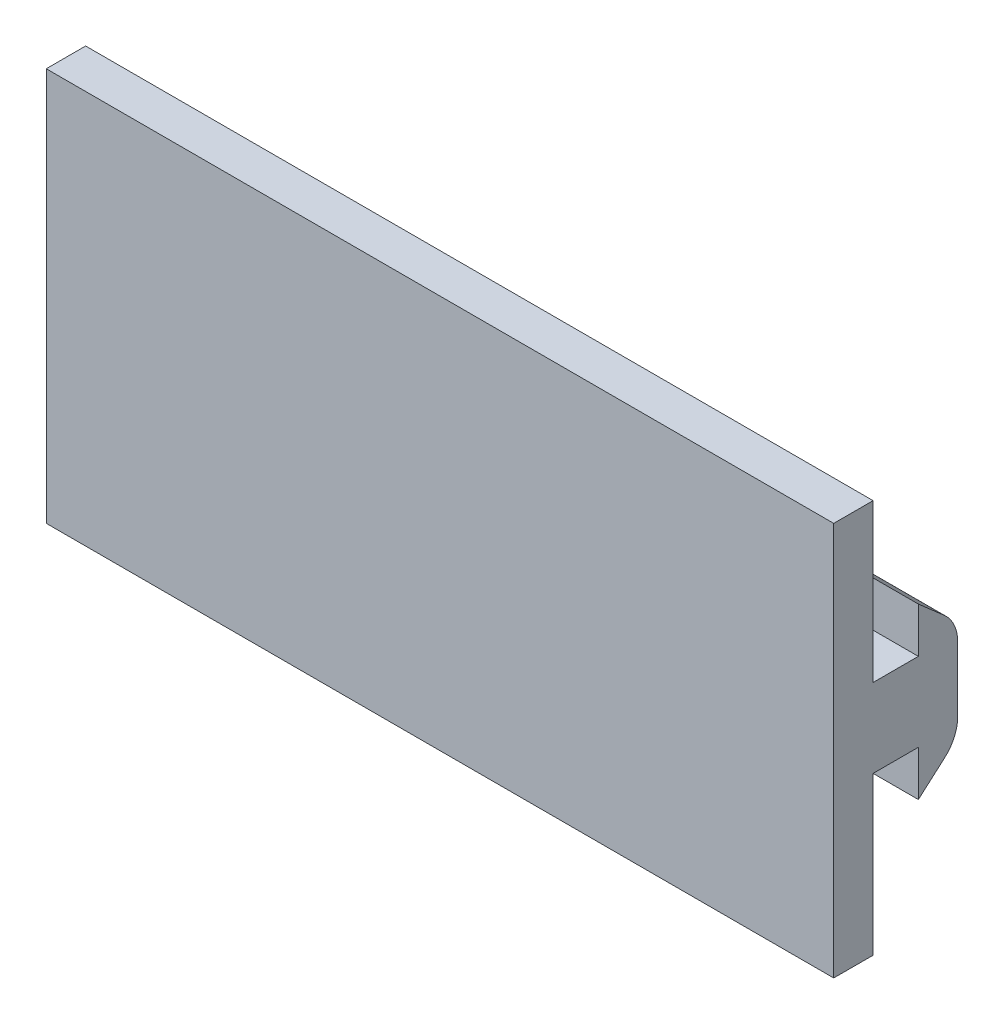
SolidWorks part; units mm, degrees
ref_plane "Front Plane" through (0, 0, 0) normal (0, 0, 1) x (1, 0, 0)
ref_plane "Top Plane" through (0, 0, 0) normal (0, 1, 0) x (1, 0, 0)
ref_plane "Right Plane" through (0, 0, 0) normal (1, 0, 0) x (0, 0, -1)
sketch "Sketch1" plane through (0, 0, 0) normal (0, 0, 1) x (1, 0, 0)
  line L1 (-41.91, -12.7) -> (41.91, -12.7)
  line L2 (-41.91, -12.7) -> (-41.91, 12.7)
  line L3 (-41.91, 12.7) -> (41.91, 12.7)
  line L4 (41.91, -12.7) -> (41.91, 12.7)
  line L5 (-41.91, -12.7) -> (41.91, 12.7) construction
  line L6 (-41.91, 12.7) -> (41.91, -12.7) construction
  point P0 (0, 0)
  dimension "D1" = 83.82
  dimension "D2" = 25.4
extrude "Boss-Extrude1" add sketch "Sketch1" along normal blind 12.7
sketch "Sketch3" plane through (0, 0, 12.7) normal (0, 0, 1) x (1, 0, 0)
  line L0 (41.91, -6.86) -> (41.91, -7.62)
  line L1 (-41.91, -6.86) -> (-41.91, -7.8218)
  line L2 (-41.4131, -6.6226) -> (-41.415, -6.71)
  line L3 (-40.3041, -6.6534) -> (-40.3058, -6.6983)
  line L6 (-40.8652, -6.1) -> (-40.8591, -6.1)
  line L7 (-38.8652, -6.1) -> (-38.8591, -6.1)
  line L12 (-39.4131, -6.6226) -> (-39.415, -6.71)
  line L13 (-38.3041, -6.6534) -> (-38.3058, -6.6983)
  line L14 (-37.4131, -6.6226) -> (-37.415, -6.71)
  line L15 (-36.8652, -6.1) -> (-36.8591, -6.1)
  line L16 (-34.8652, -6.1) -> (-34.8591, -6.1)
  line L17 (-32.8652, -6.1) -> (-32.8591, -6.1)
  line L18 (-30.8652, -6.1) -> (-30.8591, -6.1)
  line L19 (-28.8652, -6.1) -> (-28.8591, -6.1)
  line L20 (-26.8654, -6.1) -> (-26.8591, -6.1)
  line L21 (-24.8652, -6.1) -> (-24.8591, -6.1)
  line L27 (34.8591, -6.1) -> (34.8652, -6.1)
  line L28 (36.8591, -6.1) -> (36.8652, -6.1)
  line L29 (38.8591, -6.1) -> (38.8652, -6.1)
  line L30 (40.8591, -6.1) -> (40.8652, -6.1)
  line L32 (32.8652, -6.1) -> (29.456, -5.9831)
  line L33 (-41.91, -12.7) -> (41.91, -12.7) construction
  line L34 (41.91, -5.465) -> (29.4688, -5.465) construction
  line L35 (41.91, -12.7) -> (41.91, 12.7) construction
  line L38 (31.565, -7.82) -> (29.0504, -7.931)
  line L40 (-41.91, -7.8218) -> (-41.91, -8.0218)
  line L41 (-41.91, -8.0218) -> (-22.86, -8.0218)
  line L42 (-22.86, -7.8218) -> (-22.86, -8.0218)
  line L45 (31.565, -7.82) -> (41.91, -7.82)
  line L46 (41.91, -7.62) -> (41.91, -7.82)
  line L47 (22.1752, -12.7) -> (24.143, -12.7)
  line L390 (33.415, -6.6226) -> (33.4131, -6.6226)
  line L391 (33.415, -6.71) -> (33.415, -6.6226)
  line L392 (34.1562, -6.86) -> (33.565, -6.86)
  line L393 (34.3041, -6.6534) -> (34.3041, -6.6559)
  line L398 (35.415, -6.6226) -> (35.4131, -6.6226)
  line L399 (35.415, -6.71) -> (35.415, -6.6226)
  line L400 (36.1562, -6.86) -> (35.565, -6.86)
  line L401 (36.3041, -6.6534) -> (36.3041, -6.6559)
  line L406 (37.415, -6.6226) -> (37.4131, -6.6226)
  line L407 (37.415, -6.71) -> (37.415, -6.6226)
  line L408 (38.1562, -6.86) -> (37.565, -6.86)
  line L409 (38.3041, -6.6534) -> (38.3041, -6.6559)
  line L414 (39.415, -6.6226) -> (39.4131, -6.6226)
  line L415 (39.415, -6.71) -> (39.415, -6.6226)
  line L416 (40.1562, -6.86) -> (39.565, -6.86)
  line L417 (40.3041, -6.6534) -> (40.3041, -6.6559)
  line L422 (41.415, -6.6226) -> (41.4131, -6.6226)
  line L423 (41.415, -6.71) -> (41.415, -6.6226)
  line L424 (41.91, -6.86) -> (41.565, -6.86)
  line L1628 (0, -27.3539) -> (0, 27.3539) construction
  line L1698 (-41.91, -6.86) -> (-41.565, -6.86)
  line L1706 (-40.1562, -6.86) -> (-39.565, -6.86)
  line L1714 (-38.1562, -6.86) -> (-37.565, -6.86)
  line L1721 (-36.3041, -6.6534) -> (-36.3041, -6.6559)
  line L1722 (-36.1562, -6.86) -> (-35.565, -6.86)
  line L1723 (-35.415, -6.71) -> (-35.415, -6.6226)
  line L1724 (-35.415, -6.6226) -> (-35.4131, -6.6226)
  line L1729 (-34.3041, -6.6534) -> (-34.3041, -6.6559)
  line L1730 (-34.1562, -6.86) -> (-33.565, -6.86)
  line L1731 (-33.415, -6.71) -> (-33.415, -6.6226)
  line L1732 (-33.415, -6.6226) -> (-33.4131, -6.6226)
  line L1737 (-32.3041, -6.6534) -> (-32.3041, -6.6559)
  line L1738 (-32.1562, -6.86) -> (-31.565, -6.86)
  line L1739 (-31.415, -6.71) -> (-31.415, -6.6226)
  line L1740 (-31.415, -6.6226) -> (-31.4131, -6.6226)
  line L1745 (-30.3041, -6.6534) -> (-30.3041, -6.6559)
  line L1746 (-30.1562, -6.86) -> (-29.565, -6.86)
  line L1747 (-29.415, -6.71) -> (-29.415, -6.6226)
  line L1748 (-29.415, -6.6226) -> (-29.4131, -6.6226)
  line L1753 (-28.3041, -6.6534) -> (-28.3041, -6.6559)
  line L1754 (-28.1562, -6.86) -> (-27.565, -6.86)
  line L1755 (-27.415, -6.71) -> (-27.415, -6.6226)
  line L1756 (-27.415, -6.6226) -> (-27.4131, -6.6226)
  line L1761 (-26.3041, -6.6535) -> (-26.3041, -6.656)
  line L1762 (-26.1563, -6.86) -> (-25.5651, -6.8601)
  line L1763 (-25.4151, -6.7101) -> (-25.4151, -6.6226)
  line L1764 (-25.4151, -6.6226) -> (-25.4132, -6.6226)
  line L1769 (-24.3041, -6.6534) -> (-24.3041, -6.6549)
  line L1770 (-24.1562, -6.86) -> (-23.565, -6.86)
  line L1771 (-23.415, -6.71) -> (-23.415, -6.6226)
  line L1772 (-23.415, -6.6226) -> (-23.4131, -6.6226)
  line L1773 (-22.8652, -6.1) -> (-22.86, -7.3726)
  line L1774 (-22.86, -7.3726) -> (-22.86, -7.8218)
  arc A3 (29.456, -5.9831) -> (22.1752, -12.7) centre (28.9139, -12.7) ccw
  arc A5 (29.0504, -7.931) -> (24.143, -12.7) centre (28.9139, -12.7) ccw
  arc A235 (33.4131, -6.6226) -> (32.8652, -6.1) centre (32.8591, -6.655) ccw
  arc A236 (33.415, -6.71) -> (33.565, -6.86) centre (33.565, -6.71) ccw
  arc A237 (34.1562, -6.86) -> (34.3058, -6.6983) centre (34.1562, -6.71) ccw
  arc A238 (34.3041, -6.6559) -> (34.3058, -6.6983) centre (34.8591, -6.655) ccw
  arc A239 (34.8591, -6.1) -> (34.3041, -6.6534) centre (34.8591, -6.655) ccw
  arc A240 (35.4131, -6.6226) -> (34.8652, -6.1) centre (34.8591, -6.655) ccw
  arc A241 (35.415, -6.71) -> (35.565, -6.86) centre (35.565, -6.71) ccw
  arc A242 (36.1562, -6.86) -> (36.3058, -6.6983) centre (36.1562, -6.71) ccw
  arc A243 (36.3041, -6.6559) -> (36.3058, -6.6983) centre (36.8591, -6.655) ccw
  arc A244 (36.8591, -6.1) -> (36.3041, -6.6534) centre (36.8591, -6.655) ccw
  arc A245 (37.4131, -6.6226) -> (36.8652, -6.1) centre (36.8591, -6.655) ccw
  arc A246 (37.415, -6.71) -> (37.565, -6.86) centre (37.565, -6.71) ccw
  arc A247 (38.1562, -6.86) -> (38.3058, -6.6983) centre (38.1562, -6.71) ccw
  arc A248 (38.3041, -6.6559) -> (38.3058, -6.6983) centre (38.8591, -6.655) ccw
  arc A249 (38.8591, -6.1) -> (38.3041, -6.6534) centre (38.8591, -6.655) ccw
  arc A250 (39.4131, -6.6226) -> (38.8652, -6.1) centre (38.8591, -6.655) ccw
  arc A251 (39.415, -6.71) -> (39.565, -6.86) centre (39.565, -6.71) ccw
  arc A252 (40.1562, -6.86) -> (40.3058, -6.6983) centre (40.1562, -6.71) ccw
  arc A253 (40.3041, -6.6559) -> (40.3058, -6.6983) centre (40.8591, -6.655) ccw
  arc A254 (40.8591, -6.1) -> (40.3041, -6.6534) centre (40.8591, -6.655) ccw
  arc A255 (41.4131, -6.6226) -> (40.8652, -6.1) centre (40.8591, -6.655) ccw
  arc A256 (41.415, -6.71) -> (41.565, -6.86) centre (41.565, -6.71) ccw
  arc A1043 (-41.415, -6.71) -> (-41.565, -6.86) centre (-41.565, -6.71) cw
  arc A1044 (-41.4131, -6.6226) -> (-40.8652, -6.1) centre (-40.8591, -6.655) cw
  arc A1045 (-40.8591, -6.1) -> (-40.3041, -6.6534) centre (-40.8591, -6.655) cw
  arc A1047 (-40.1562, -6.86) -> (-40.3058, -6.6983) centre (-40.1562, -6.71) cw
  arc A1048 (-39.415, -6.71) -> (-39.565, -6.86) centre (-39.565, -6.71) cw
  arc A1049 (-39.4131, -6.6226) -> (-38.8652, -6.1) centre (-38.8591, -6.655) cw
  arc A1050 (-38.8591, -6.1) -> (-38.3041, -6.6534) centre (-38.8591, -6.655) cw
  arc A1052 (-38.1562, -6.86) -> (-38.3058, -6.6983) centre (-38.1562, -6.71) cw
  arc A1053 (-37.415, -6.71) -> (-37.565, -6.86) centre (-37.565, -6.71) cw
  arc A1054 (-37.4131, -6.6226) -> (-36.8652, -6.1) centre (-36.8591, -6.655) cw
  arc A1055 (-36.8591, -6.1) -> (-36.3041, -6.6534) centre (-36.8591, -6.655) cw
  arc A1056 (-36.3041, -6.6559) -> (-36.3058, -6.6983) centre (-36.8591, -6.655) cw
  arc A1057 (-36.1562, -6.86) -> (-36.3058, -6.6983) centre (-36.1562, -6.71) cw
  arc A1058 (-35.415, -6.71) -> (-35.565, -6.86) centre (-35.565, -6.71) cw
  arc A1059 (-35.4131, -6.6226) -> (-34.8652, -6.1) centre (-34.8591, -6.655) cw
  arc A1060 (-34.8591, -6.1) -> (-34.3041, -6.6534) centre (-34.8591, -6.655) cw
  arc A1061 (-34.3041, -6.6559) -> (-34.3058, -6.6983) centre (-34.8591, -6.655) cw
  arc A1062 (-34.1562, -6.86) -> (-34.3058, -6.6983) centre (-34.1562, -6.71) cw
  arc A1063 (-33.415, -6.71) -> (-33.565, -6.86) centre (-33.565, -6.71) cw
  arc A1064 (-33.4131, -6.6226) -> (-32.8652, -6.1) centre (-32.8591, -6.655) cw
  arc A1065 (-32.8591, -6.1) -> (-32.3041, -6.6534) centre (-32.8591, -6.655) cw
  arc A1066 (-32.3041, -6.6559) -> (-32.3058, -6.6983) centre (-32.8591, -6.655) cw
  arc A1067 (-32.1562, -6.86) -> (-32.3058, -6.6983) centre (-32.1562, -6.71) cw
  arc A1068 (-31.415, -6.71) -> (-31.565, -6.86) centre (-31.565, -6.71) cw
  arc A1069 (-31.4131, -6.6226) -> (-30.8652, -6.1) centre (-30.8591, -6.655) cw
  arc A1070 (-30.8591, -6.1) -> (-30.3041, -6.6534) centre (-30.8591, -6.655) cw
  arc A1071 (-30.3041, -6.6559) -> (-30.3058, -6.6983) centre (-30.8591, -6.655) cw
  arc A1072 (-30.1562, -6.86) -> (-30.3058, -6.6983) centre (-30.1562, -6.71) cw
  arc A1073 (-29.415, -6.71) -> (-29.565, -6.86) centre (-29.565, -6.71) cw
  arc A1074 (-29.4131, -6.6226) -> (-28.8652, -6.1) centre (-28.8591, -6.655) cw
  arc A1075 (-28.8591, -6.1) -> (-28.3041, -6.6534) centre (-28.8591, -6.655) cw
  arc A1076 (-28.3041, -6.6559) -> (-28.3058, -6.6983) centre (-28.8591, -6.655) cw
  arc A1077 (-28.1562, -6.86) -> (-28.3058, -6.6983) centre (-28.1562, -6.71) cw
  arc A1078 (-27.415, -6.71) -> (-27.565, -6.86) centre (-27.565, -6.71) cw
  arc A1079 (-27.4131, -6.6226) -> (-26.8654, -6.1) centre (-26.8591, -6.655) cw
  arc A1080 (-26.8591, -6.1) -> (-26.3041, -6.6535) centre (-26.8591, -6.655) cw
  arc A1081 (-26.3041, -6.656) -> (-26.3058, -6.6983) centre (-26.8591, -6.655) cw
  arc A1082 (-26.1563, -6.86) -> (-26.3058, -6.6983) centre (-26.1563, -6.71) cw
  arc A1083 (-25.4151, -6.7101) -> (-25.5651, -6.8601) centre (-25.5651, -6.7101) cw
  arc A1084 (-25.4132, -6.6226) -> (-24.8652, -6.1) centre (-24.8591, -6.655) cw
  arc A1085 (-24.8591, -6.1) -> (-24.3041, -6.6534) centre (-24.8591, -6.655) cw
  arc A1086 (-24.3041, -6.6549) -> (-24.3058, -6.6983) centre (-24.8591, -6.655) cw
  arc A1087 (-24.1562, -6.86) -> (-24.3058, -6.6983) centre (-24.1562, -6.71) cw
  arc A1088 (-23.415, -6.71) -> (-23.565, -6.86) centre (-23.565, -6.71) cw
  arc A1089 (-23.4131, -6.6226) -> (-22.8652, -6.1) centre (-22.8591, -6.655) cw
  point P24 (0, 0)
  dimension "D1" = 0.635
  dimension "D3" = 0.76
sketch "Sketch4" plane through (0, 0, 12.7) normal (0, 0, 1) x (1, 0, 0)
  line L1 (-19.05, -12.7) -> (19.05, -12.7)
  line L2 (-19.05, -12.7) -> (-19.05, 12.7)
  line L3 (-19.05, 12.7) -> (19.05, 12.7)
  line L4 (19.05, -12.7) -> (19.05, 12.7)
  line L5 (-19.05, -12.7) -> (19.05, 12.7) construction
  line L6 (-19.05, 12.7) -> (19.05, -12.7) construction
  point P0 (0, 0)
  dimension "D1" = 38.1
extrude "Boss-Extrude2" add sketch "Sketch4" along normal blind 38.1
sketch "Sketch5" plane through (0, 12.7, 0) normal (0, 1, 0) x (1, 0, 0)
  line L1 (-13.335, -45.085) -> (13.335, -45.085)
  line L2 (-13.335, -45.085) -> (-13.335, -18.415)
  line L3 (-13.335, -18.415) -> (13.335, -18.415)
  line L4 (13.335, -45.085) -> (13.335, -18.415)
  line L5 (-13.335, -45.085) -> (13.335, -18.415) construction
  line L6 (-13.335, -18.415) -> (13.335, -45.085) construction
  line L8 (-19.05, -50.8) -> (-19.05, -12.7) construction
  line L9 (19.05, -50.8) -> (-19.05, -50.8) construction
  point P0 (0, -31.75)
  point P9 (0, -31.75)
  dimension "D1" = 19.05
  dimension "D2" = 26.67
  dimension "D3" = 26.67
  dimension "D4" = 19.05
extrude "Cut-Extrude1" cut sketch "Sketch5" against normal blind 19.05
sketch "Sketch7" plane through (0, -6.35, 0) normal (0, 1, 0) x (1, 0, 0)
  line L0 (-13.335, -45.085) -> (13.335, -45.085) construction
  circle A0 centre (0, -31.75) radius 3.429
  point P0 (0, -31.75)
  dimension "D2" = 6.858
  dimension "D1" = 13.335
extrude "Cut-Extrude2" cut sketch "Sketch7" against normal through all
sketch "Sketch8" plane through (-41.91, 0, 0) normal (-1, 0, 0) x (0, 0, 1)
  line L0 (0, 12.7) -> (0, -12.7) construction
  line L2 (-5.461, 2.085) -> (-5.461, -2.085)
  line L5 (0, 2.54) -> (0, -2.54)
  line L7 (-4.5942, 3.996) -> (-2.921, 5.461)
  line L8 (-2.921, 5.461) -> (-2.921, 2.54)
  line L10 (-2.921, -5.461) -> (-2.921, -2.54)
  line L11 (-4.5942, -3.996) -> (-2.921, -5.461)
  line L12 (-2.921, 2.54) -> (0, 2.54)
  line L13 (-2.921, -2.54) -> (0, -2.54)
  arc A0 (-4.5942, 3.996) -> (-5.461, 2.085) centre (-2.921, 2.085) ccw
  arc A1 (-5.461, -2.085) -> (-4.5942, -3.996) centre (-2.921, -2.085) ccw
  point P0 (-3.937, -1.0959)
  dimension "D1" = 2.54
  dimension "D2" = 2.54
  dimension "D7" = 2.921
  dimension "D3" = 5.08
  dimension "D4" = 2.921
  dimension "D5" = 2.54
  dimension "D6" = 2.921
  dimension "D8" = 2.921
  dimension "D9" = 2.54
extrude "Boss-Extrude3" add sketch "Sketch8" against normal blind 83.82
sketch "Sketch10" plane through (41.91, 0, 0) normal (1, 0, 0) x (0, 0, -1)
  line L0 (-12.7, -12.7) -> (-12.7, 12.7) construction
  line L1 (-12.7, 7.62) -> (-4.7, 7.62)
  line L2 (-12.7, 7.62) -> (-12.7, 3.62)
  line L3 (-12.7, 3.62) -> (-4.7, 3.62)
  line L4 (-4.7, 7.62) -> (-4.7, 3.62)
  line L5 (-12.7, 12.7) -> (0, 12.7) construction
  dimension "D1" = 8
  dimension "D2" = 4
  dimension "D3" = 5.08
extrude "Cut-Extrude3" cut sketch "Sketch10" against normal through all
extrude "Cut-Extrude4" cut sketch "Sketch3" against normal blind 6
sketch "Sketch11" plane through (-41.91, 0, 0) normal (-1, 0, 0) x (0, 0, 1)
  line L0 (12.7, 12.7) -> (0, 12.7) construction
  line L1 (2.54, 12.7) -> (50.8, 12.7)
  line L2 (2.54, 12.7) -> (2.54, -12.7)
  line L3 (2.54, -12.7) -> (50.8, -12.7)
  line L4 (50.8, 12.7) -> (50.8, -12.7)
  line L5 (0, 12.7) -> (0, 2.54) construction
  dimension "D1" = 2.54
extrude "Cut-Extrude5" cut sketch "Sketch11" against normal through all
sketch "Sketch12" plane through (0, 0, 2.54) normal (0, 0, 1) x (1, 0, 0)
  line L0 (41.91, 12.7) -> (-41.91, 12.7) construction
  line L1 (8.89, 12.7) -> (41.91, 12.7)
  line L2 (8.89, 12.7) -> (8.89, -12.7)
  line L3 (8.89, -12.7) -> (41.91, -12.7)
  line L4 (41.91, 12.7) -> (41.91, -12.7)
  line L5 (-41.91, 12.7) -> (-41.91, -12.7) construction
  dimension "D1" = 50.8
extrude "Cut-Extrude6" cut sketch "Sketch12" against normal through all
